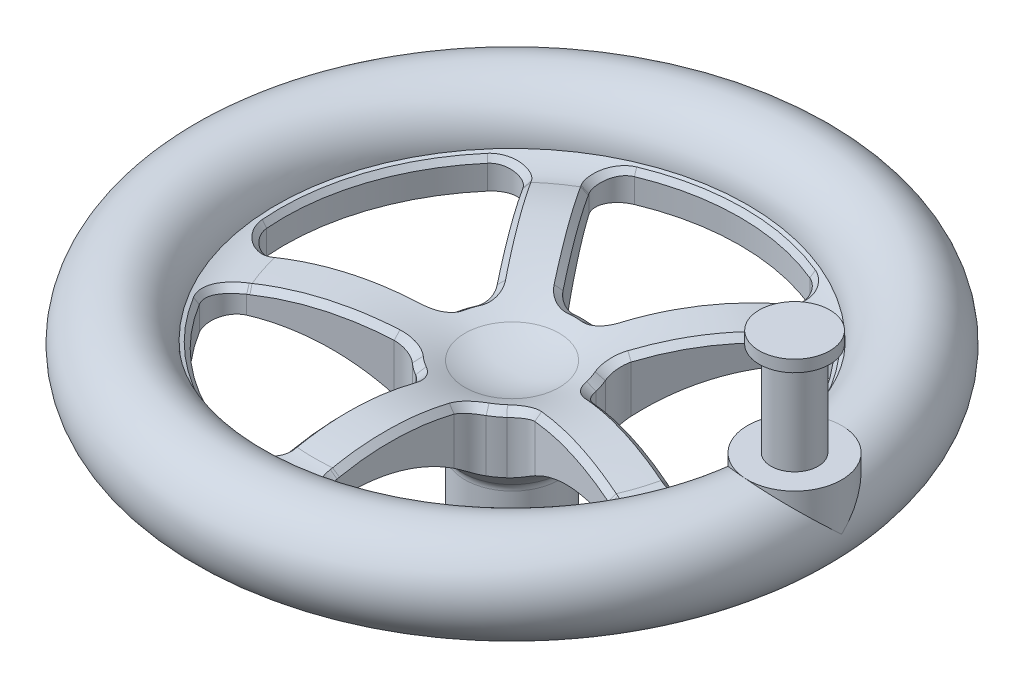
SolidWorks part; units mm, degrees
ref_plane "Front" through (0, 0, 0) normal (0, 0, 1) x (1, 0, 0)
ref_plane "Top" through (0, 0, 0) normal (0, 1, 0) x (1, 0, 0)
ref_plane "Right" through (0, 0, 0) normal (1, 0, 0) x (0, 0, -1)
sketch "Sketch1" plane through (0, 0, 0) normal (0, 0, 1) x (1, 0, 0)
  line L0 (0, 0) -> (0, 38.8183) construction
  line L1 (0, 0) -> (6.35, 0)
  line L2 (6.35, 0) -> (6.35, 12.7)
  line L3 (0, 22.225) -> (38.1, 22.225) construction
  line L4 (0, 0) -> (38.1, 0) construction
  line L5 (38.1, 0) -> (38.1, 25.4) construction
  line L6 (0, 0) -> (0, 22.225)
  line L7 (0, 38.8183) -> (6.35, 23.4881) construction
  arc A0 (6.7342, 13.7355) -> (6.35, 12.7) centre (7.9375, 12.7) ccw
  arc A1 (6.7342, 13.7355) -> (25.2399, 22.225) centre (25.2399, -2.1894) cw
  arc A2 (33.8999, 20.6375) -> (31.7614, 25.7797) centre (38.1, 25.4) ccw
  arc A3 (26.7101, 25.439) -> (6.35, 23.4881) centre (19.7152, -8.7784) ccw
  arc A4 (0, 22.225) -> (6.35, 23.4881) centre (0, 38.8183) ccw
  arc A5 (25.2399, 22.225) -> (33.8999, 20.6375) centre (25.2399, -2.1894) cw
  arc A6 (26.7101, 25.439) -> (31.7614, 25.7797) centre (28.6178, 34.771) ccw
  dimension "D3" = 12.7
  dimension "D6" = 12.7
  dimension "D7" = 9.525
  dimension "D9" = 1.5875
  dimension "D10" = 6.35
  dimension "D11" = 3.175
  dimension "D1" = 22.5
  dimension "D2" = 1.5875
  dimension "D12" = 34.925
  dimension "D4" = 25.4
  dimension "D8" = 22.225
  dimension "Diam" = 76.2
revolve "Base-Revolve" add sketch "Sketch1" angle 360 about L0
sketch "Sketch3" plane through (0, 0, 0) normal (0, 0, 1) x (1, 0, 0)
  line L0 (38.1, 25.4) -> (38.1, 19.05) construction
  line L2 (38.1, 25.4) -> (38.1, 46.0375)
  line L3 (38.1, 46.0375) -> (42.8625, 46.0375)
  line L4 (44.45, 31.75) -> (44.45, 25.4)
  line L5 (44.45, 31.75) -> (41.275, 31.75)
  line L6 (41.275, 44.45) -> (41.275, 31.75)
  line L7 (41.275, 44.45) -> (42.8625, 44.45)
  line L8 (42.8625, 46.0375) -> (42.8625, 44.45)
  line L9 (44.45, 25.4) -> (38.1, 25.4)
  line L11 (38.1, 31.75) -> (44.45, 31.75) construction
  circle A1 centre (38.1, 25.4) radius 6.35 construction
  arc A2 (33.8999, 20.6375) -> (31.7614, 25.7797) centre (38.1, 25.4) ccw construction
  dimension "D1" = 6.35
  dimension "D2" = 9.525
  dimension "D3" = 12.7
  dimension "D4" = 1.5875
revolve "Boss-Revolve1" add sketch "Sketch3" angle 360 about L0
sketch "Sketch2" plane through (0, 0, 0) normal (0, -1, 0) x (1, 0, 0)
  line L0 (0, 0) -> (0, 33.8999) construction
  line L1 (3.175, 26.782) -> (3.175, 10.9985)
  line L2 (-3.175, 30.5348) -> (-3.175, 8.9803) construction
  line L3 (24.49, 11.2957) -> (9.4791, 6.4183)
  line L6 (0, 0) -> (19.9258, 27.4256) construction
  arc A1 (4.7625, 8.2489) -> (3.175, 10.9985) centre (6.35, 10.9985) cw
  circle A2 centre (0, 0) radius 9.525
  arc A3 (6.3735, 7.0785) -> (4.7625, 8.2489) centre (0, 0) ccw
  circle A4 centre (0, 0) radius 30.6995
  circle A5 centre (0, 0) radius 33.8999 construction
  arc A6 (26.2207, 15.9666) -> (7.0825, 29.8713) centre (0, 0) ccw
  arc A7 (7.0825, 29.8713) -> (3.175, 26.782) centre (6.35, 26.782) ccw
  arc A8 (6.3735, 7.0785) -> (9.4791, 6.4183) centre (8.498, 9.4379) ccw
  arc A9 (26.2207, 15.9666) -> (24.49, 11.2957) centre (23.5089, 14.3153) cw
  circle A10 centre (0, 0) radius 33.8999 construction
  point P18 (3.175, 8.9803)
  point P21 (3.175, 30.5348)
  dimension "D4" = 3.175
  dimension "D5" = 36
  dimension "D3" = 6.35
  dimension "D1" = 3.175
  dimension "D2" = 3.2004
extrude "Cut-Extrude1" cut sketch "Sketch2" against normal through all
chamfer "Chamfer2" distance 0.7937 angle 45
pattern_circular "CirPattern1" count 5 every 72 about axis through (0, 0, 0) along (0, 1, 0)
equation "\"D2@CirPattern1\" = 360/\"D1@CirPattern1\""
equation "\"D5@Sketch2\"= 360/\"D1@CirPattern1\"/2"
equation "\"D12@Sketch1\"=.55*(\"Diam@Sketch1\"-.5)"
